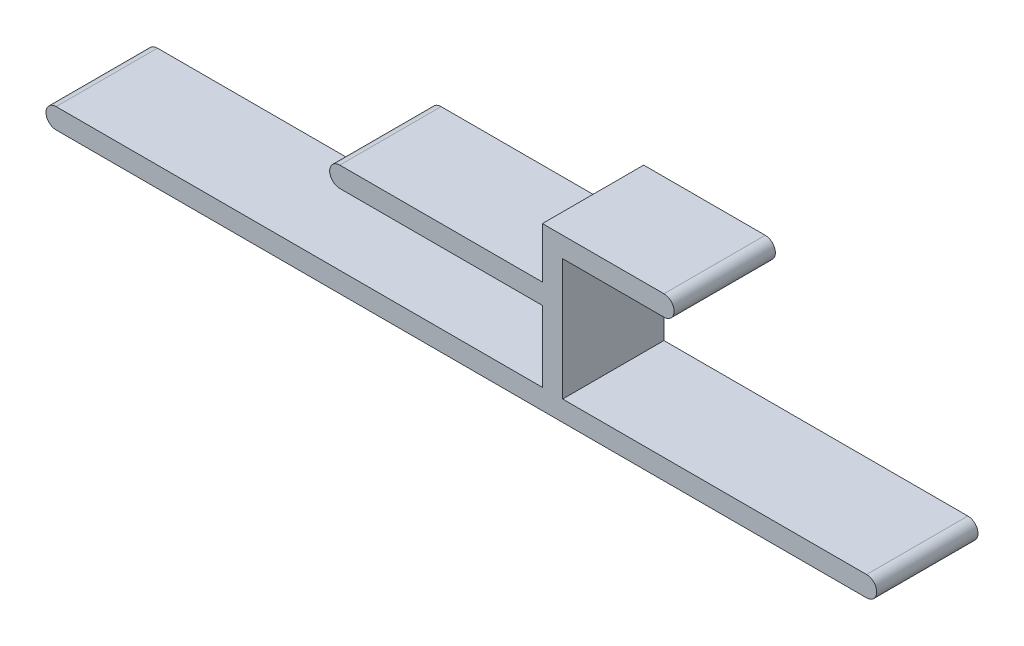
SolidWorks part; units mm, degrees
ref_plane "Front Plane" through (0, 0, 0) normal (0, 0, 1) x (1, 0, 0)
ref_plane "Top Plane" through (0, 0, 0) normal (0, 1, 0) x (1, 0, 0)
ref_plane "Right Plane" through (0, 0, 0) normal (1, 0, 0) x (0, 0, -1)
sketch "Sketch1" plane through (0, 0, 0) normal (0, 0, 1) x (0, -1, 0)
  line L0 (0, -50) -> (0, -2)
  line L1 (-7, -22) -> (-7, -2)
  line L2 (0, 0) -> (-12, 0)
  line L3 (-12, 0) -> (-12, 10)
  line L4 (-9, -22) -> (-9, -2)
  line L5 (0, -2) -> (-7, -2)
  line L6 (-14, -2) -> (-14, 10)
  line L7 (2, -50) -> (2, 30)
  line L8 (-9, -2) -> (-14, -2)
  line L9 (0, 0) -> (0, 30)
  line L10 (0, -2) -> (-14, -2) construction
  line L11 (-9, -22) -> (-9, -2) construction
  line L13 (0, -50) -> (0, 30) construction
  arc A0 (-7, -22) -> (-9, -22) centre (-8, -22) cw
  arc A3 (-12, 10) -> (-14, 10) centre (-13, 10) ccw
  arc A4 (0, -50) -> (2, -50) centre (1, -50) ccw
  arc A5 (0, 30) -> (2, 30) centre (1, 30) cw
  dimension "D1" = 30
  dimension "D2" = 20
  dimension "D3" = 7
  dimension "D4" = 12
  dimension "D5" = 50
  dimension "D6" = 10
  dimension "D7" = 2
  dimension "D8" = 2
extrude "Boss-Extrude1" add sketch "Sketch1" along normal blind 10
